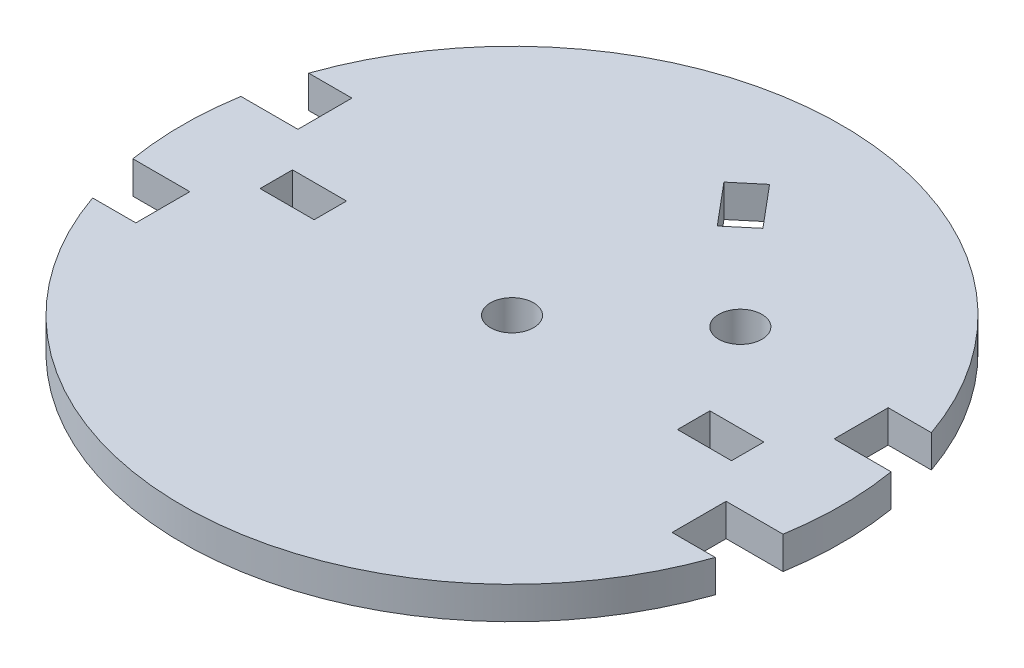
SolidWorks part; units mm, degrees
ref_plane "Alzado" through (0, 0, 0) normal (0, 0, 1) x (1, 0, 0)
ref_plane "Planta" through (0, 0, 0) normal (0, 1, 0) x (1, 0, 0)
ref_plane "Vista lateral" through (0, 0, 0) normal (1, 0, 0) x (0, 0, -1)
sketch "Croquis1" plane through (0, 0, 0) normal (0, 1, 0) x (1, 0, 0)
  circle A0 centre (0, 0) radius 30.5
extrude "Saliente-Extruir1" add sketch "Croquis1" along normal blind 3
sketch "Croquis2" plane through (0, 3, 0) normal (0, 1, 0) x (1, 0, 0)
  circle A0 centre (0, 0) radius 2
extrude "Cortar-Extruir1" cut sketch "Croquis2" against normal blind 4
sketch "Croquis5" plane through (0, 3, 0) normal (0, 1, 0) x (1, 0, 0)
  line L0 (0, 0) -> (0, 10)
  line L1 (28.8141, -5) -> (30.0874, -5)
  line L2 (28.8141, 5) -> (30.0874, 5)
  line L3 (-24.8141, 10) -> (-28.8141, 10)
  line L4 (24.8141, -5) -> (24.8141, -10)
  line L5 (-24.8141, -10) -> (-28.8141, -10)
  line L6 (24.8141, -5) -> (28.8141, -5)
  line L7 (24.8141, 5) -> (24.8141, 10)
  line L8 (-24.8141, 5) -> (-28.8141, 5)
  line L9 (-24.8141, 5) -> (-24.8141, 10)
  line L10 (-24.8141, -5) -> (-28.8141, -5)
  line L11 (-24.8141, -5) -> (-24.8141, -10)
  line L12 (24.8141, 5) -> (28.8141, 5)
  line L13 (24.8141, -10) -> (28.8141, -10)
  line L14 (24.8141, 10) -> (28.8141, 10)
  line L15 (-28.8141, 5) -> (-30.0874, 5)
  line L16 (-28.8141, -5) -> (-30.0874, -5)
  circle A1 centre (0, 0) radius 30.5 construction
  arc A2 (-28.8141, 10) -> (-30.0874, 5) centre (0, 0) ccw
  arc A3 (28.8141, 10) -> (28.8141, -10) centre (0, 0) cw
  arc A4 (-30.0874, -5) -> (-28.8141, -10) centre (0, 0) ccw
  arc A5 (30.0874, -5) -> (28.8141, -10) centre (0, 0) cw
  arc A6 (28.8141, 10) -> (30.0874, 5) centre (0, 0) cw
extrude "Cortar-Extruir3" cut sketch "Croquis5" against normal blind 4
sketch "Croquis6" plane through (0, 3, 0) normal (0, 1, 0) x (1, 0, 0)
  line L1 (-16.8141, -1.5) -> (-16.8141, 1.5)
  line L2 (-16.8141, 1.5) -> (-21.8141, 1.5)
  line L3 (-21.8141, 1.5) -> (-21.8141, -1.5)
  line L4 (-16.8141, -1.5) -> (-21.8141, -1.5)
  line L5 (16.8141, -1.5) -> (21.8141, -1.5)
  line L6 (21.8141, 1.5) -> (21.8141, -1.5)
  line L7 (16.8141, 1.5) -> (21.8141, 1.5)
  line L8 (16.8141, -1.5) -> (16.8141, 1.5)
extrude "Cortar-Extruir4" cut sketch "Croquis6" against normal blind 4
sketch "Croquis7" plane through (0, 3, 0) normal (0, 1, 0) x (1, 0, 0)
  line L0 (-8.1011, 29.1011) -> (9.5756, 8.0348)
  line L1 (9.5756, 8.0348) -> (27.2522, -13.0314)
  line L2 (-8.1011, 29.1011) -> (-27.2522, 13.0314)
  line L3 (27.2522, -13.0314) -> (8.1011, -29.1011)
  line L4 (8.1011, -29.1011) -> (-27.2522, 13.0314)
  line L5 (1.4284, 22.4114) -> (-0.8697, 20.4831)
  line L6 (1.4284, 22.4114) -> (4.6423, 18.5812)
  line L7 (4.6423, 18.5812) -> (2.3442, 16.6528)
  line L8 (2.3442, 16.6528) -> (-0.8697, 20.4831)
  circle A0 centre (11.4907, 9.6418) radius 2
  point P7 (-9.5756, -8.0348)
extrude "Cortar-Extruir5" cut sketch "Croquis7" against normal blind 4 contours A0 | L7 L6 L5 L0
